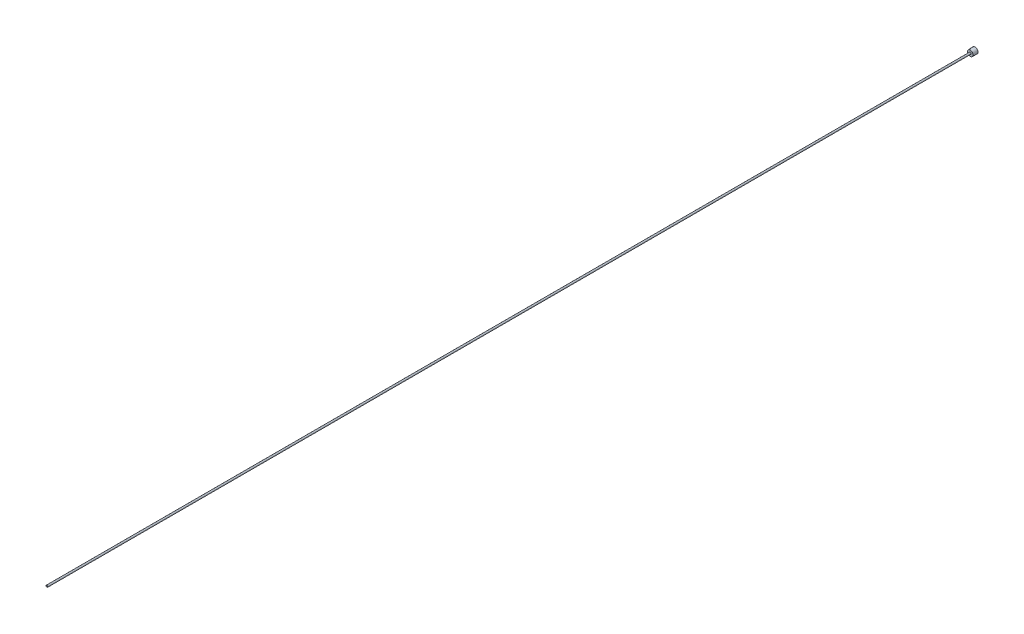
SolidWorks part; units mm, degrees
ref_plane "Front Plane" through (0, 0, 0) normal (0, 0, 1) x (1, 0, 0)
ref_plane "Top Plane" through (0, 0, 0) normal (0, 1, 0) x (1, 0, 0)
ref_plane "Right Plane" through (0, 0, 0) normal (1, 0, 0) x (0, 0, -1)
sketch "Sketch1" plane through (0, 0, 0) normal (1, 0, 0) x (0, 0, -1)
  line L0 (-1219.2, 0) -> (0, 0)
  line L5 (0, 3.8989) -> (-6.35, 3.6674)
  line L6 (0, 0) -> (0, 3.8989)
  line L7 (-6.35, 3.6674) -> (-6.35, 1.143)
  line L8 (-6.35, 1.143) -> (-1219.2, 1.143)
  line L9 (-1219.2, 1.143) -> (-1219.2, 0)
  line L10 (0, 0) -> (49989.3417, 0) construction
  dimension "D1" = 2.088
  dimension "D2" = 6.35
  dimension "D3" = 1219.2
  dimension "D4" = 2.286
  dimension "D5" = 7.7978
revolve "Revolve1" add sketch "Sketch1" angle 360 about L10
sketch "Sketch2" plane through (0, 0, 1219.2) normal (0, 0, 1) x (1, 0, 0)
  circle A0 centre (0, 0) radius 0.9652
  dimension "D1" = 1.9304
extrude "Cut-Extrude1" cut sketch "Sketch2" against normal through all
sketch "Sketch3" plane through (0, 0, 0) normal (0, 0, -1) x (-1, 0, 0)
  line L0 (0, 4.2888) -> (0, -4.2888) construction
  line L1 (2.3812, -1.3748) -> (2.3812, 1.3748)
  line L2 (2.3812, 1.3748) -> (0, 2.7496)
  line L3 (0, 2.7496) -> (-2.3812, 1.3748)
  line L4 (-2.3812, 1.3748) -> (-2.3812, -1.3748)
  line L5 (-2.3812, -1.3748) -> (0, -2.7496)
  line L6 (0, -2.7496) -> (2.3812, -1.3748)
  circle A0 centre (0, 0) radius 2.3812 construction
  dimension "D1" = 4.7625
extrude "Cut-Extrude2" cut sketch "Sketch3" against normal blind 3.9688
